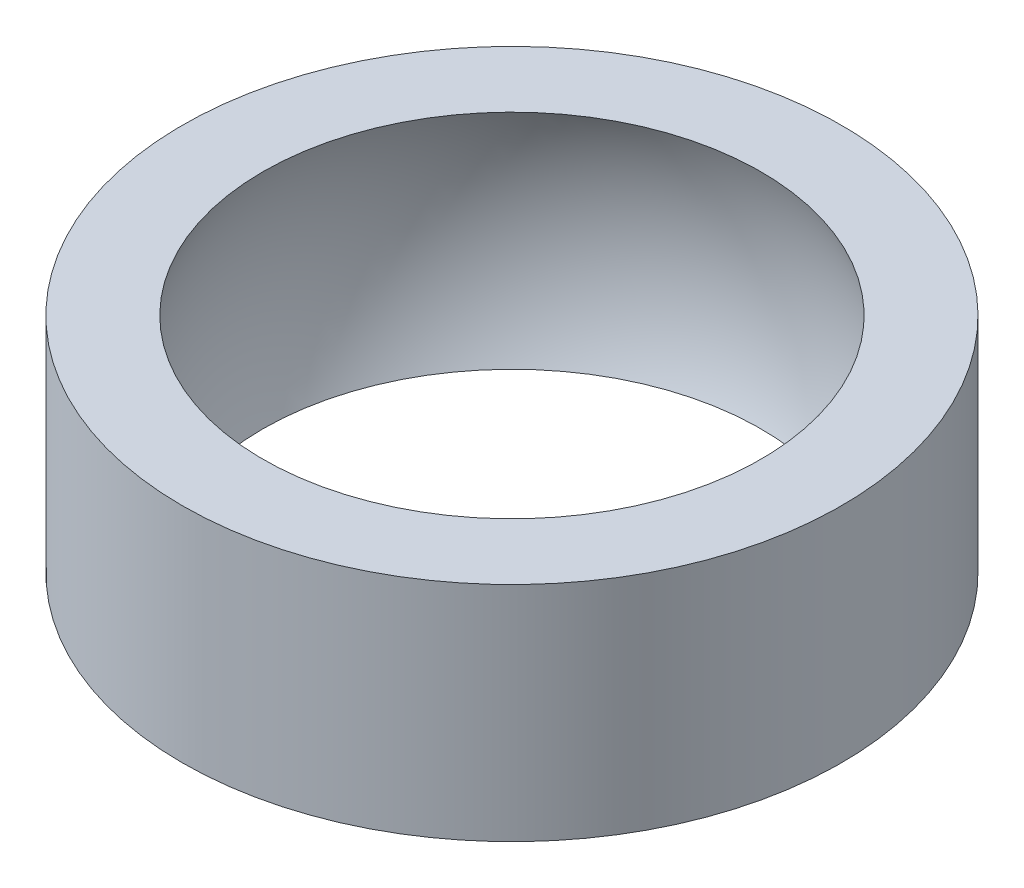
SolidWorks part; units mm, degrees
ref_plane "Plane1" through (0, 0, 0) normal (0, 0, 1) x (1, 0, 0)
ref_plane "Plane2" through (0, 0, 0) normal (0, 1, 0) x (1, 0, 0)
ref_plane "Plane3" through (0, 0, 0) normal (1, 0, 0) x (0, 0, -1)
sketch "Esquisse1" plane through (0, 0, 0) normal (0, 0, 1) x (1, 0, 0)
  line L0 (0, 16.9251) -> (0, -16.9251) construction
  line L1 (-29.6, -10) -> (-22.3663, -10)
  line L2 (-29.6, 10) -> (-22.3663, 10)
  line L3 (-29.6, 10) -> (-29.6, -10)
  arc A0 (-22.3663, 10) -> (-22.3663, -10) centre (0, 0) ccw
revolve "Base-Révolution" add sketch "Esquisse1" angle 360 about L0
equation "\"D4@Esquisse1\" = \"D3@Esquisse1\" / 2"
